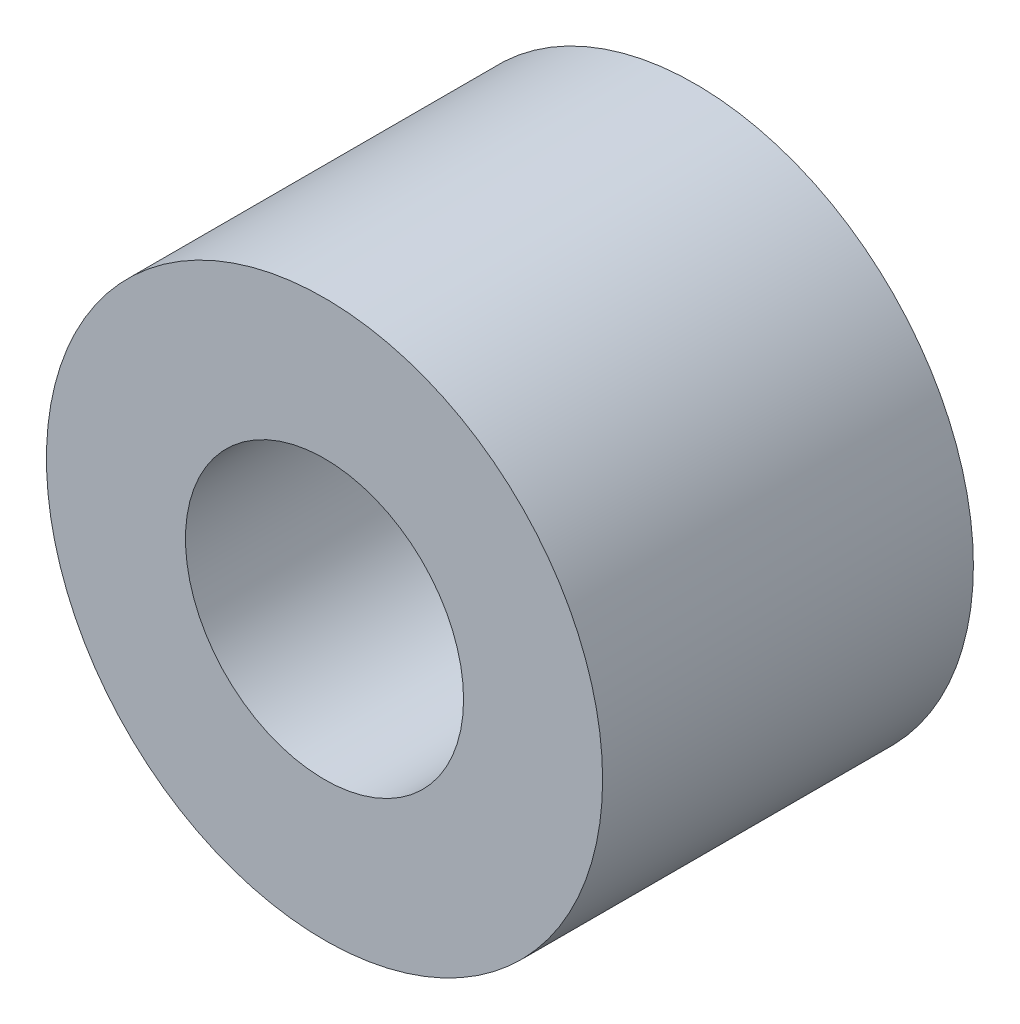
SolidWorks part; units mm, degrees
ref_plane "Plan de face" through (0, 0, 0) normal (0, 0, 1) x (1, 0, 0)
ref_plane "Plan de dessus" through (0, 0, 0) normal (0, 1, 0) x (1, 0, 0)
ref_plane "Plan de droite" through (0, 0, 0) normal (1, 0, 0) x (0, 0, -1)
sketch "Esquisse1" plane through (0, 0, 0) normal (0, 0, 1) x (1, 0, 0)
  circle A0 centre (0, 0) radius 3
  circle A1 centre (0, 0) radius 1.5
extrude "Extrusion1" add sketch "Esquisse1" along normal blind 4
